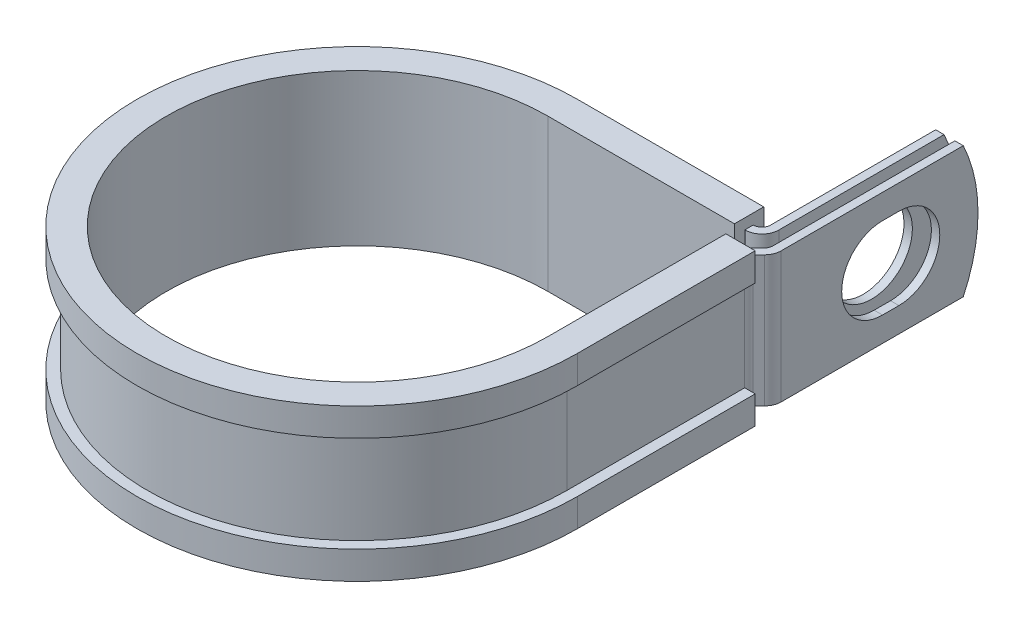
SolidWorks part; units mm, degrees
ref_plane "Front Plane" through (0, 0, 0) normal (0, 0, 1) x (1, 0, 0)
ref_plane "Top Plane" through (0, 0, 0) normal (0, 1, 0) x (1, 0, 0)
ref_plane "Right Plane" through (0, 0, 0) normal (1, 0, 0) x (0, 0, -1)
sketch "Sketch1" plane through (0, 0, 0) normal (0, 1, 0) x (1, 0, 0)
  line L0 (0, 29.2989) -> (27.1832, 29.2989)
  line L1 (29.2989, 0) -> (29.2989, 25.8864)
  line L2 (29.6216, 57.9374) -> (29.6216, 31.7373)
  line L3 (30.0131, 27.6106) -> (30.8393, 28.4368)
  line L5 (31.1964, 29.2989) -> (31.1964, 57.9374)
  arc A0 (0, 29.2989) -> (29.2989, 0) centre (0, 0) ccw
  arc A1 (30.0131, 27.6106) -> (29.2989, 25.8864) centre (31.7373, 25.8864) ccw
  arc A2 (30.8393, 28.4368) -> (31.1964, 29.2989) centre (29.9772, 29.2989) ccw
  arc A3 (27.1832, 29.2989) -> (29.6216, 31.7373) centre (27.1832, 31.7373) ccw
extrude "Extrude-Thin1" add sketch "Sketch1" along normal mid plane 19.05 thin
sketch "Sketch2" plane through (28.4024, 0, 0) normal (-1, 0, 0) x (0, 0, 1)
  line L0 (-57.9374, 9.525) -> (-57.9374, -9.525) construction
  line L1 (0, 9.525) -> (0, -9.525) construction
  circle A0 centre (-45.2374, 0) radius 5.9436
  point P2 (-57.9374, 0)
extrude "Cut-Extrude1" cut sketch "Sketch2" against normal up to surface (1.2192 mm away)
sketch "Sketch3" plane through (32.4156, 0, 0) normal (1, 0, 0) x (0, 0, -1)
  line L0 (44.0436, 0) -> (46.4312, 0) construction
  line L1 (44.0436, 5.9436) -> (46.4312, 5.9436)
  line L2 (44.0436, -5.9436) -> (46.4312, -5.9436)
  line L3 (57.9374, 9.525) -> (57.9374, -9.525) construction
  arc A0 (44.0436, 5.9436) -> (44.0436, -5.9436) centre (44.0436, 0) ccw
  arc A1 (46.4312, -5.9436) -> (46.4312, 5.9436) centre (46.4312, 0) ccw
  point P3 (45.2374, 0)
  point P8 (57.9374, 0)
  point P11 (38.1, 0)
  point P12 (52.3748, 0)
extrude "Cut-Extrude2" cut sketch "Sketch3" against normal up to surface (1.2192 mm away)
sketch "Sketch4" plane through (28.4024, 0, 0) normal (-1, 0, 0) x (0, 0, 1)
  line L0 (-57.9374, 9.525) -> (-57.9374, -9.525)
  line L1 (-57.9374, 9.525) -> (-55.7929, 9.525)
  line L2 (-57.9374, 9.525) -> (-31.7373, 9.525) construction
  line L3 (-57.9374, -9.525) -> (-55.7929, -9.525)
  line L4 (-57.9374, -9.525) -> (-31.7373, -9.525) construction
  arc A0 (-55.7929, 9.525) -> (-55.7929, -9.525) centre (-35.7124, 0) ccw
extrude "Cut-Extrude3" cut sketch "Sketch4" against normal through all contours A0 M4 M5 | A0 L0 M2
ref_plane "Plane1" through (0, 0, -25.8864) normal (0, 0, -1) x (-1, 0, 0)
ref_plane "Plane2" through (27.1324, 0, 0) normal (-1, 0, 0) x (0, 0, 1)
sketch "Sketch5" plane through (0, 0, -25.8864) normal (0, 0, -1) x (-1, 0, 0)
  line L0 (-30.5181, 9.525) -> (-29.2989, 9.525)
  line L1 (-30.5181, 9.525) -> (-30.5181, -9.525) construction
  line L3 (-29.2989, 9.525) -> (-29.2989, -9.525)
  line L4 (-29.2989, -9.525) -> (-30.5181, -9.525)
  line L5 (-30.5181, -9.525) -> (-30.5181, -6.985)
  line L6 (-30.5181, 9.525) -> (-30.5181, 6.985)
  line L7 (-32.0421, 11.049) -> (-32.0421, 6.985)
  line L8 (-32.0421, 11.049) -> (-27.7749, 11.049)
  line L9 (-27.7749, 11.049) -> (-27.7749, -11.049)
  line L10 (-27.7749, -11.049) -> (-32.0421, -11.049)
  line L11 (-32.0421, -11.049) -> (-32.0421, -6.985)
  line L12 (-32.0421, 6.985) -> (-30.5181, 6.985)
  line L13 (-30.5181, -6.985) -> (-32.0421, -6.985)
sketch "Sketch6" plane through (0, 9.525, 0) normal (0, 1, 0) x (1, 0, 0)
  line L0 (27.7749, 0) -> (27.7749, 25.8864)
  line L1 (27.7749, 25.8864) -> (32.0421, 25.8864) construction
  line L2 (27.1324, 6.9878) -> (27.1324, -6.9878) construction
  line L5 (0, 27.7749) -> (27.1324, 27.7749)
  arc A0 (0, 27.7749) -> (27.7749, 0) centre (0, 0) ccw
sweep "Sweep1" add profiles "Sketch5" path "Sketch6"
equation "\"D4@Sketch5\" = \"D1@Extrude-Thin1\""
equation "\"D5@Sketch5\" = \"D5@Extrude-Thin1\""
equation "\"D1@Sketch3\" = \"D2@Sketch2\""
equation "\"D7@Sketch1\" = \"D3@Sketch2\" + \"D1@Sketch3\""
equation "\"D1@Sketch1\" = \"D1@Sketch6\" + 2 * \"D3@Sketch5\""
equation "\"D1@Sketch4\" = ( \"D1@Extrude-Thin1\" + .125 ) * 2"
equation "\"D9@Sketch1\"= \"D5@Extrude-Thin1\""
equation "\"D8@Sketch1\"= 2 * \"D5@Extrude-Thin1\""
equation "\"D2@Sketch1\" = 2 * \"D5@Extrude-Thin1\""
equation "\"D2@Sketch3\" = \"D1@Sketch2\""
